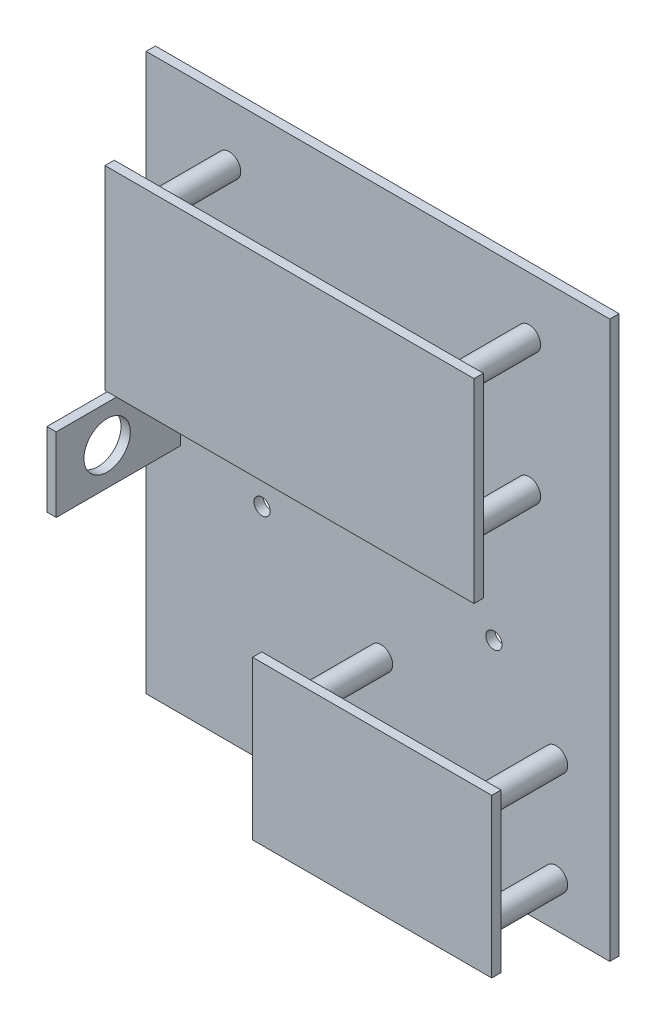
SolidWorks part; units mm, degrees
ref_plane "Plan de face" through (0, 0, 0) normal (0, 0, 1) x (1, 0, 0)
ref_plane "Plan de dessus" through (0, 0, 0) normal (0, 1, 0) x (1, 0, 0)
ref_plane "Plan de droite" through (0, 0, 0) normal (1, 0, 0) x (0, 0, -1)
sketch "Esquisse1" plane through (0, 0, 0) normal (0, 0, 1) x (1, 0, 0)
  line L1 (0, 0) -> (100, 0)
  line L2 (0, 0) -> (0, 120)
  line L3 (0, 120) -> (100, 120)
  line L4 (100, 0) -> (100, 120)
  dimension "D1" = 100
  dimension "D2" = 120
extrude "Boss.-Extru.1" add sketch "Esquisse1" along normal blind 2
sketch "Esquisse2" plane through (0, 0, 2) normal (0, 0, 1) x (1, 0, 0)
  line L3 (17.9039, 107.7205) -> (82.5848, 107.7205) construction
  line L4 (17.9039, 107.7205) -> (17.9039, 79.3504) construction
  line L5 (17.9039, 79.3504) -> (82.5848, 79.3504) construction
  line L6 (82.5848, 107.7205) -> (82.5848, 79.3504) construction
  line L7 (50.6659, 31.9991) -> (88.419, 31.9991) construction
  line L8 (50.6659, 31.9991) -> (50.6659, 9.6594) construction
  line L9 (50.6659, 9.6594) -> (88.419, 9.6594) construction
  line L10 (88.419, 31.9991) -> (88.419, 9.6594) construction
  circle A0 centre (17.9039, 107.7205) radius 2.5
  circle A1 centre (82.5848, 107.7205) radius 2.5
  circle A2 centre (82.5848, 79.3504) radius 2.5
  circle A3 centre (17.9039, 79.3504) radius 2.5
  circle A4 centre (50.6659, 31.9991) radius 2.5
  circle A5 centre (88.419, 31.9991) radius 2.5
  circle A6 centre (88.419, 9.6594) radius 2.5
  circle A7 centre (50.6659, 9.6594) radius 2.5
  dimension "D1" = 5
  dimension "D5" = 2
extrude "Boss.-Extru.2" add sketch "Esquisse2" along normal blind 18
sketch "Esquisse4" plane through (0, 0, 0) normal (0, 0, -1) x (-1, 0, 0)
  line L0 (0, 120) -> (0, 0) construction
  line L1 (-75, 72.5) -> (-25, 72.5) construction
  line L2 (-75, 72.5) -> (-75, 47.5) construction
  line L3 (-75, 47.5) -> (-25, 47.5) construction
  line L4 (-25, 72.5) -> (-25, 47.5) construction
  line L5 (0, 0) -> (-100, 0) construction
  circle A0 centre (-75, 72.5) radius 1.75
  circle A1 centre (-75, 47.5) radius 1.75
  circle A2 centre (-25, 47.5) radius 1.75
  circle A3 centre (-25, 72.5) radius 1.75
  dimension "D5" = 3.5
  dimension "D1" = 50
  dimension "D2" = 25
  dimension "D3" = 25
  dimension "D4" = 47.5
sketch "Esquisse5" plane through (0, 0, 20) normal (0, 0, 1) x (1, 0, 0)
  line L1 (11.1201, 114.2315) -> (90.7255, 114.2315)
  line L2 (11.1201, 114.2315) -> (11.1201, 72.2187)
  line L3 (11.1201, 72.2187) -> (90.7255, 72.2187)
  line L4 (90.7255, 114.2315) -> (90.7255, 72.2187)
  line L5 (42.9518, 38.2996) -> (94.5374, 38.2996)
  line L6 (42.9518, 38.2996) -> (42.9518, 4.176)
  line L7 (42.9518, 4.176) -> (94.5374, 4.176)
  line L8 (94.5374, 38.2996) -> (94.5374, 4.176)
extrude "Boss.-Extru.4" add sketch "Esquisse5" along normal blind 2
sketch "Esquisse6" plane through (0, 0, 0) normal (0, 1, 0) x (1, 0, 0)
  line L0 (0.279, -2) -> (7.3778, -2)
  line L1 (0, -2) -> (100, -2) construction
  line L2 (7.3778, -2) -> (7.3778, -28.7765)
  line L3 (1.4921, -0.787) -> (-1.5775, -3.8566) construction
extrude "Extru.-Mince1" add sketch "Esquisse6" along normal blind 16 from offset 50 thin
sketch "Esquisse9" plane through (5.3778, 0, 0) normal (-1, 0, 0) x (0, 0, 1)
  line L0 (4, 66) -> (28.7765, 66) construction
  circle A0 centre (17.8, 58) radius 5
  dimension "D2" = 10
  dimension "D1" = 8
extrude "Enlèv. mat.-Extru.2" cut sketch "Esquisse9" against normal blind 16
extrude "Enlèv. mat.-Extru.3" cut sketch "Esquisse4" against normal blind 10
